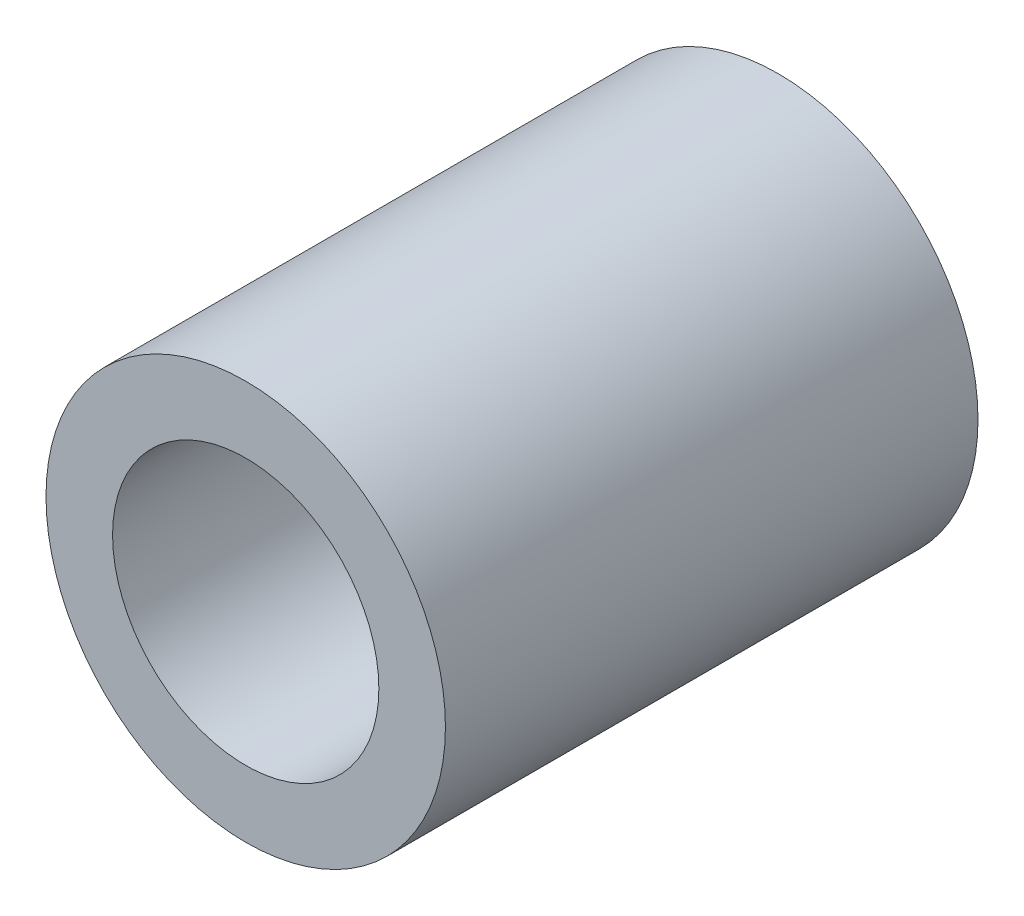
SolidWorks part; units mm, degrees
ref_plane "Plan1" through (0, 0, 0) normal (0, 0, 1) x (1, 0, 0)
ref_plane "Plan2" through (0, 0, 0) normal (0, 1, 0) x (1, 0, 0)
ref_plane "Plan3" through (0, 0, 0) normal (1, 0, 0) x (0, 0, -1)
sketch "Esquisse1" plane through (0, 0, 0) normal (0, 0, 1) x (1, 0, 0)
  circle A0 centre (0, 0) radius 12
  circle A1 centre (0, 0) radius 8
  dimension "D1" = 24
  dimension "D2" = 16
extrude "Base-Extrusion" add sketch "Esquisse1" along normal blind 32
ref_plane "Plan4" through (0, 0, 16) normal (0, 0, -1) x (-1, 0, 0)
sketch "Esquisse2" plane through (0, 0, 16) normal (0, 0, -1) x (-1, 0, 0)
  point P0 (0, 0)
